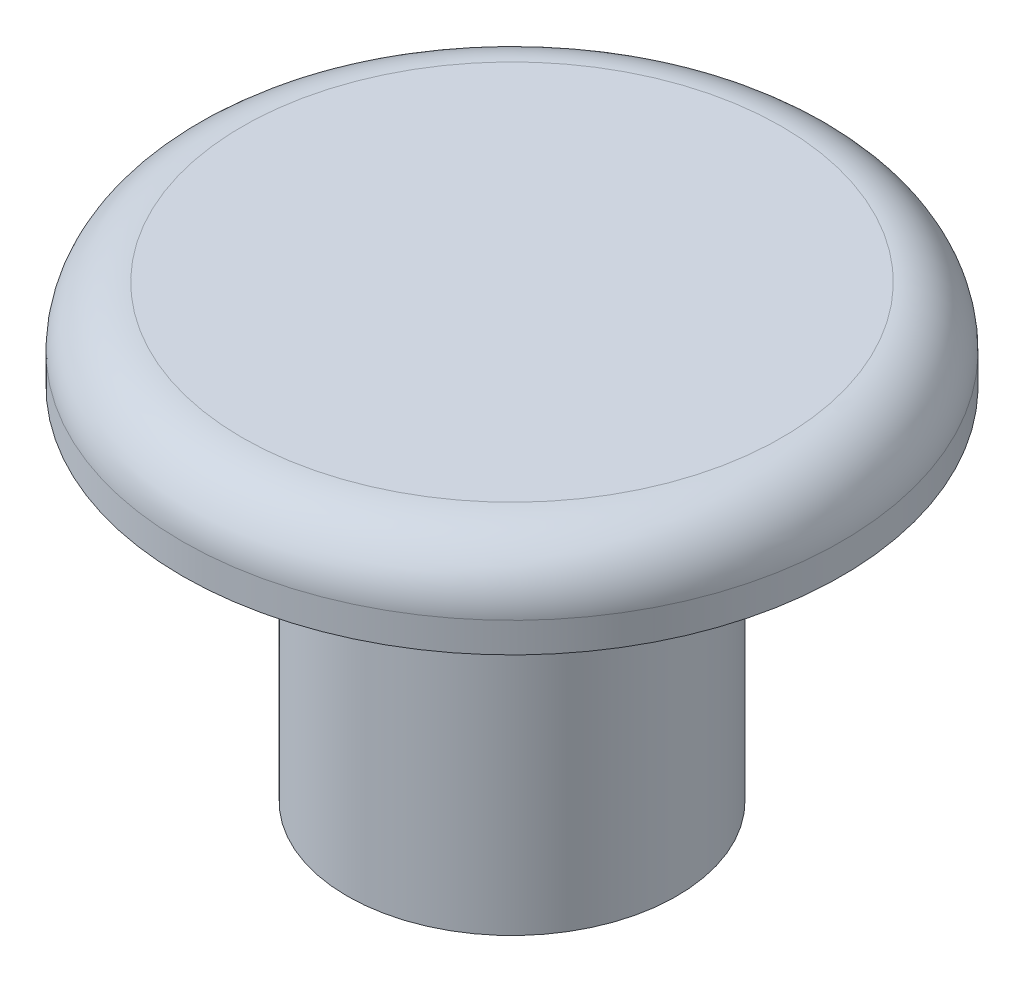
SolidWorks part; units mm, degrees
ref_plane "Front Plane" through (0, 0, 0) normal (0, 0, 1) x (1, 0, 0)
ref_plane "Top Plane" through (0, 0, 0) normal (0, 1, 0) x (1, 0, 0)
ref_plane "Right Plane" through (0, 0, 0) normal (1, 0, 0) x (0, 0, -1)
sketch "Sketch1" plane through (0, 0, 0) normal (0, 0, 1) x (1, 0, 0)
  line L0 (0, 0) -> (0, 15)
  line L1 (0, 15) -> (9, 15)
  line L2 (11, 13) -> (11, 12)
  line L3 (11, 12) -> (5.5, 12)
  line L4 (5.5, 12) -> (5.5, 0)
  line L5 (5.5, 0) -> (0, 0)
  line L6 (0, 0) -> (0, -47.6414) construction
  arc A0 (9, 15) -> (11, 13) centre (9, 13) cw
  point P10 (11, 15)
  dimension "D5" = 2
  dimension "D1" = 11
  dimension "D2" = 22
  dimension "D3" = 3
  dimension "D4" = 12
revolve "Revolve1" add sketch "Sketch1" angle 360 about L6
